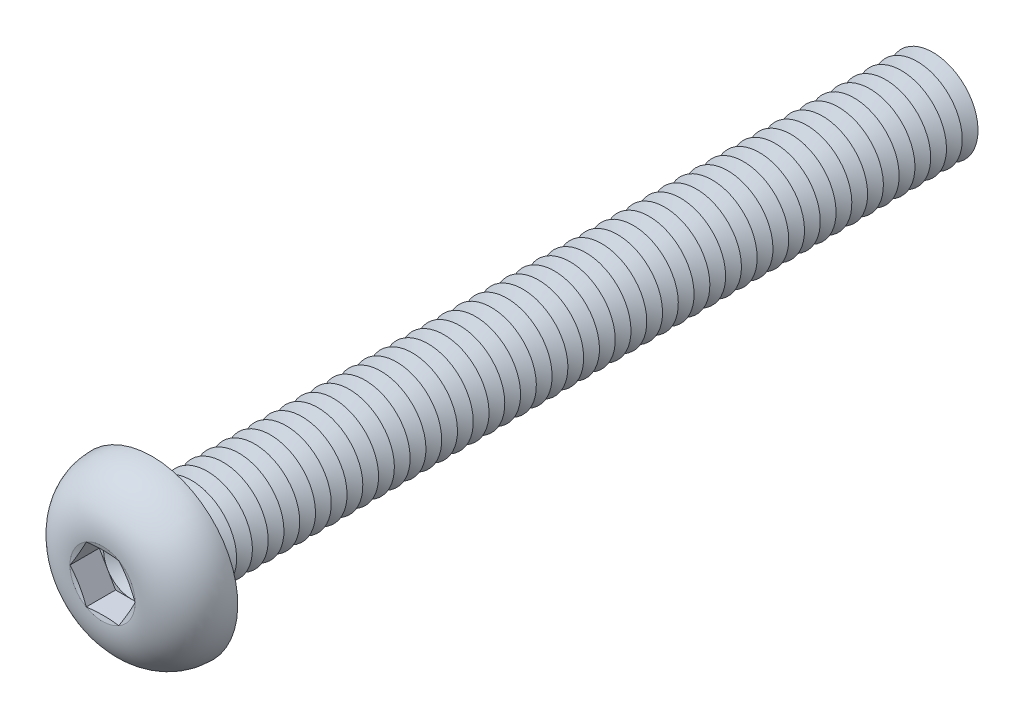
SolidWorks part; units mm, degrees
ref_plane "Front Plane" through (0, 0, 0) normal (0, 0, 1) x (1, 0, 0)
ref_plane "Top Plane" through (0, 0, 0) normal (0, 1, 0) x (1, 0, 0)
ref_plane "Right Plane" through (0, 0, 0) normal (1, 0, 0) x (0, 0, -1)
sketch "Sketch1" plane through (0, 0, 0) normal (1, 0, 0) x (0, 0, -1)
  line L0 (0, 2) -> (0, 3.8)
  line L3 (0, 2) -> (35, 2)
  line L4 (35, 2) -> (35, 0)
  line L5 (35, 0) -> (-2.2, 0) construction
  line L6 (-2.2, 0) -> (35, 0)
  line L7 (-2.2, 1.4434) -> (-2.2, 0.7217) construction
  line L8 (-2.2, 0.7217) -> (-2.2, 0)
  line L9 (-2.2, 1.4434) -> (-2.0066, 0.7217)
  line L10 (-2.0066, 0.7217) -> (-2.2, 0.7217)
  line L11 (35, 0) -> (22.7481, 0) construction
  line L12 (0, 3.8) -> (-2.2, 3.8) construction
  arc A1 (0, 3.8) -> (-2.2, 1.4434) centre (0, 1.5948) ccw
  point P8 (35, 1)
  dimension "D1" = 7.6
  dimension "D2" = 4
  dimension "D3" = 2.2
  dimension "D4" = 2.8868
  dimension "D5" = 35
  dimension "D6" = 15
revolve "Revolve1" add sketch "Sketch1" angle 360 about L5
fillet "Fillet1" radius 0.35 1 edges at (0, 2, 0)
sketch "Sketch2" plane through (0, 0, 0) normal (1, 0, 0) x (0, 0, -1)
  line L0 (34.65, 2) -> (35.35, 2)
  line L1 (35, 2) -> (0.35, 2) construction
  line L2 (35.35, 2) -> (35, 1.3938)
  line L3 (35, -2) -> (35, 2) construction
  line L4 (35, 1.3938) -> (34.65, 2)
  dimension "D1" = 0.7
revolve "Cut-Revolve1" cut sketch "Sketch2" angle 360 about axis through (0, 0, -35) along (0, 0, -1)
pattern_linear "LPattern1" count 50 spacing 0.7 along (0, 0, 1) of "Cut-Revolve1"
sketch "Sketch3" plane through (0, 0, 2.2) normal (0, 0, 1) x (1, 0, 0)
  line L7 (0.7217, 1.25) -> (-0.7217, 1.25)
  line L8 (-0.7217, 1.25) -> (-1.4434, 0)
  line L9 (-1.4434, 0) -> (-0.7217, -1.25)
  line L10 (-0.7217, -1.25) -> (0.7217, -1.25)
  line L11 (0.7217, -1.25) -> (1.4434, 0)
  line L12 (1.4434, 0) -> (0.7217, 1.25)
  circle A0 centre (0, 0) radius 1.25 construction
  circle A3 centre (0, 0) radius 1.4434 construction
extrude "Cut-Extrude1" cut sketch "Sketch3" against normal blind 1.3
sketch "Sketch4" plane through (0, 0, 0.9) normal (0, 0, 1) x (1, 0, 0)
  line L1 (0.7217, 1.25) -> (-0.7217, 1.25) construction
  circle A0 centre (0, 0) radius 1.25
extrude "Cut-Extrude2" cut sketch "Sketch4" against normal through all draft 60
